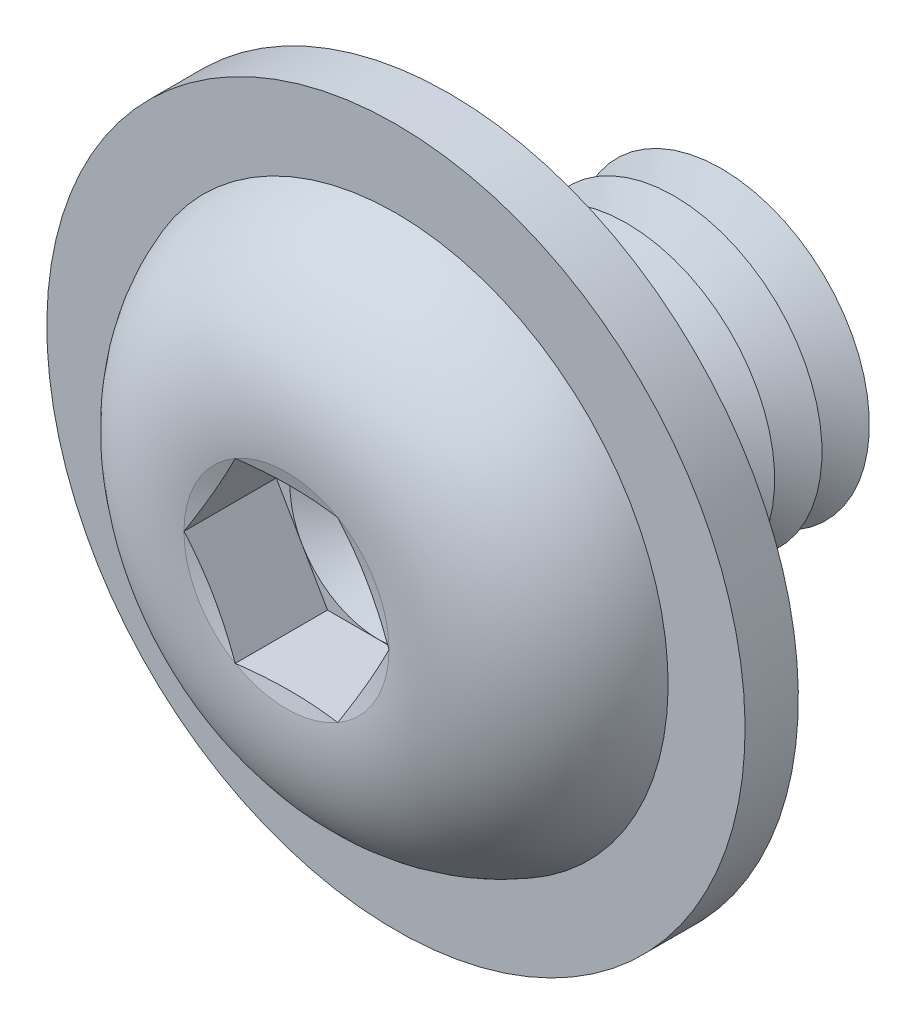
SolidWorks part; units mm, degrees
ref_plane "Front Plane" through (0, 0, 0) normal (0, 0, 1) x (1, 0, 0)
ref_plane "Top Plane" through (0, 0, 0) normal (0, 1, 0) x (1, 0, 0)
ref_plane "Right Plane" through (0, 0, 0) normal (1, 0, 0) x (0, 0, -1)
sketch "Sketch1" plane through (0, 0, 0) normal (1, 0, 0) x (0, 0, -1)
  line L0 (0, 2.5) -> (0, 4.75)
  line L3 (0, 2.5) -> (5, 2.5)
  line L4 (5, 2.5) -> (5, 0)
  line L5 (5, 0) -> (-2.75, 0) construction
  line L6 (-2.75, 0) -> (5, 0)
  line L7 (-2.75, 1.732) -> (-2.75, 0.866) construction
  line L8 (-2.75, 0.866) -> (-2.75, 0)
  line L9 (-2.75, 1.732) -> (-2.5179, 0.866)
  line L10 (-2.5179, 0.866) -> (-2.75, 0.866)
  line L11 (5, 0) -> (22.7481, 0) construction
  line L12 (0, 4.75) -> (-2.75, 4.75) construction
  arc A1 (0, 4.75) -> (-2.75, 1.732) centre (0, 1.9881) ccw
  point P8 (5, 1.25)
  dimension "D1" = 9.5
  dimension "D2" = 5
  dimension "D3" = 2.75
  dimension "D4" = 3.4641
  dimension "D5" = 5
  dimension "D6" = 15
revolve "Revolve1" add sketch "Sketch1" angle 360 about L5
fillet "Fillet1" radius 0.4 1 edges at (0, 2.5, 0)
sketch "Sketch2" plane through (0, 0, 0) normal (1, 0, 0) x (0, 0, -1)
  line L0 (4.6, 2.5) -> (5.4, 2.5)
  line L1 (5, 2.5) -> (0.4, 2.5) construction
  line L2 (5.4, 2.5) -> (5, 1.8072)
  line L3 (5, -2.5) -> (5, 2.5) construction
  line L4 (5, 1.8072) -> (4.6, 2.5)
  dimension "D1" = 0.8
revolve "Cut-Revolve1" cut sketch "Sketch2" angle 360 about axis through (0, 0, -5) along (0, 0, -1)
pattern_linear "LPattern1" count 6 spacing 0.8 along (0, 0, 1) of "Cut-Revolve1"
sketch "Sketch3" plane through (0, 0, 2.75) normal (0, 0, 1) x (1, 0, 0)
  line L7 (0.866, 1.5) -> (-0.866, 1.5)
  line L8 (-0.866, 1.5) -> (-1.7321, 0)
  line L9 (-1.7321, 0) -> (-0.866, -1.5)
  line L10 (-0.866, -1.5) -> (0.866, -1.5)
  line L11 (0.866, -1.5) -> (1.7321, 0)
  line L12 (1.7321, 0) -> (0.866, 1.5)
  circle A0 centre (0, 0) radius 1.5 construction
  circle A3 centre (0, 0) radius 1.7321 construction
extrude "Cut-Extrude1" cut sketch "Sketch3" against normal blind 1.56
sketch "Sketch4" plane through (0, 0, 1.19) normal (0, 0, 1) x (1, 0, 0)
  line L1 (0.866, 1.5) -> (-0.866, 1.5) construction
  circle A0 centre (0, 0) radius 1.5
extrude "Cut-Extrude2" cut sketch "Sketch4" against normal through all draft 60
sketch "Sketch5" plane through (0, 0, 0) normal (0, 0, -1) x (-1, 0, 0)
  circle A0 centre (0, 0) radius 5.9
  circle A1 centre (0, 0) radius 2.9
  circle A2 centre (0, 0) radius 2.9 construction
  dimension "D1" = 11.8
extrude "Boss-Extrude1" add sketch "Sketch5" against normal blind 0.9
